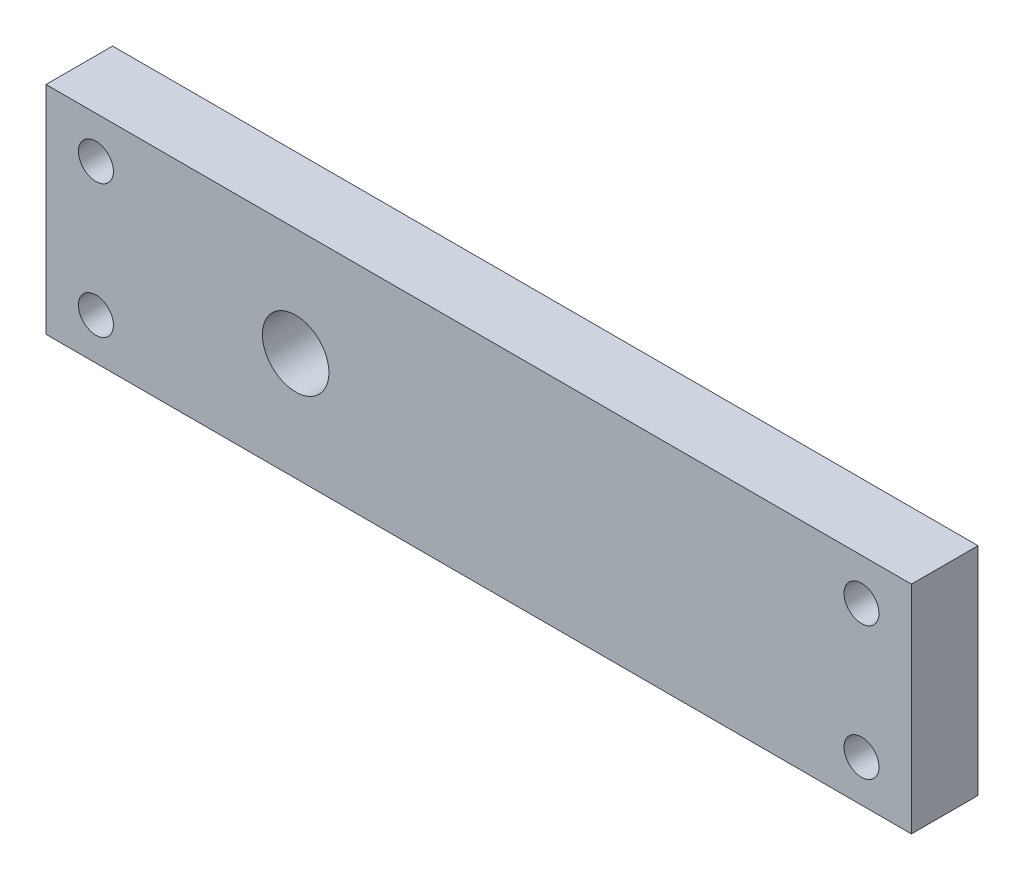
SolidWorks part; units mm, degrees
ref_plane "Face" through (0, 0, 0) normal (0, 0, 1) x (1, 0, 0)
ref_plane "Dessus" through (0, 0, 0) normal (0, 1, 0) x (1, 0, 0)
ref_plane "Droite" through (0, 0, 0) normal (1, 0, 0) x (0, 0, -1)
sketch "Esquisse1" plane through (0, 0, 0) normal (0, 0, 1) x (1, 0, 0)
  line L1 (0, 0) -> (104, 0)
  line L2 (0, 0) -> (0, 26)
  line L3 (0, 26) -> (104, 26)
  line L4 (104, 0) -> (104, 26)
  dimension "D1" = 104
  dimension "D2" = 26
extrude "Extrusion1" add sketch "Esquisse1" along normal blind 8
sketch "Esquisse2" plane through (0, 0, 8) normal (0, 0, 1) x (1, 0, 0)
  line L0 (104, 26) -> (0, 26) construction
  line L1 (0, 26) -> (0, 0) construction
  circle A0 centre (30, 13) radius 4
  dimension "D1" = 8
  dimension "D2" = 13
  dimension "D3" = 30
extrude "Enlèv. mat.-Extru.1" cut sketch "Esquisse2" against normal through all
hole_wizard "Trou taraudé M51" positions "Esquisse4" profile "Esquisse3" tap size "M5" standard "ISO"
sketch "Esquisse4" plane through (0, 0, 8) normal (0, 0, 1) x (1, 0, 0)
  line L0 (104, 26) -> (0, 26) construction
  line L1 (0, 0) -> (104, 0) construction
  line L2 (0, 26) -> (0, 0) construction
  line L3 (104, 0) -> (104, 26) construction
  point P0 (6, 21)
  point P1 (6, 5)
  point P3 (98, 21)
  point P5 (98, 5)
  dimension "D1" = 5
  dimension "D2" = 5
  dimension "D3" = 5
  dimension "D4" = 5
  dimension "D5" = 6
  dimension "D6" = 6
  dimension "D7" = 6
  dimension "D8" = 6
sketch "Esquisse3" plane through (6, 21, 8) normal (1, 0, 0) x (0, -1, 0)
  line L0 (0, 0) -> (0, 8)
  line L1 (0, 8) -> (2.1, 8)
  line L2 (2.1, 8) -> (2.1, 0)
  line L5 (2.1, 0) -> (0, 0)
  line L11 (0, -6.35) -> (0, 107.95) construction
  dimension "Diamètre du trou pour taraudage jusqu'au prochain" = 4.2
  dimension "Profondeur du trou pour taraudage jusqu'au prochain" = 8
